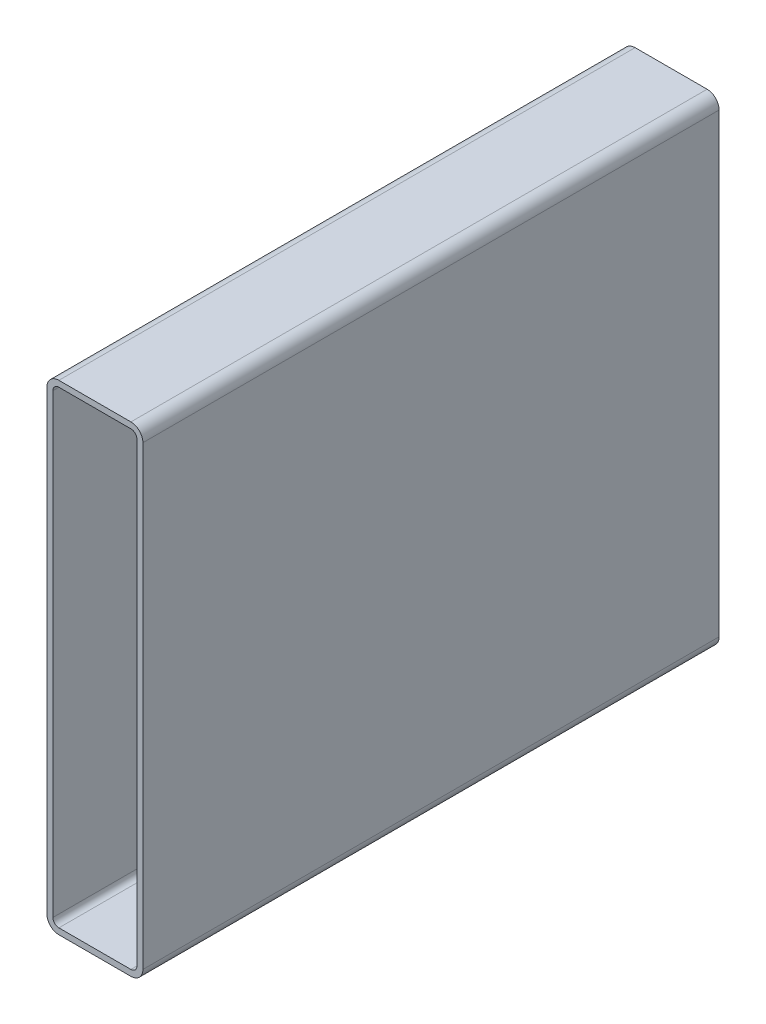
SolidWorks part; units mm, degrees
ref_plane "Front Plane" through (0, 0, 0) normal (0, 0, 1) x (1, 0, 0)
ref_plane "Top Plane" through (0, 0, 0) normal (0, 1, 0) x (1, 0, 0)
ref_plane "Right Plane" through (0, 0, 0) normal (1, 0, 0) x (0, 0, -1)
sketch "Sketch1" plane through (0, 0, 0) normal (0, 0, 1) x (1, 0, 0)
  line B0 (6.35, 254) -> (44.45, 254)
  arc B1 (50.8, 247.65) -> (44.45, 254) centre (44.45, 247.65) ccw
  line B2 (50.8, 247.65) -> (50.8, 6.35)
  arc B3 (44.45, 0) -> (50.8, 6.35) centre (44.45, 6.35) ccw
  line B4 (44.45, 0) -> (6.35, 0)
  arc B5 (0, 6.35) -> (6.35, 0) centre (6.35, 6.35) ccw
  line B6 (0, 6.35) -> (0, 247.65)
  arc B7 (6.35, 254) -> (0, 247.65) centre (6.35, 247.65) ccw
  line B8 (6.35, 250.825) -> (44.45, 250.825)
  arc B9 (47.625, 247.65) -> (44.45, 250.825) centre (44.45, 247.65) ccw
  line B10 (47.625, 247.65) -> (47.625, 6.35)
  arc B11 (44.45, 3.175) -> (47.625, 6.35) centre (44.45, 6.35) ccw
  line B12 (44.45, 3.175) -> (6.35, 3.175)
  arc B13 (3.175, 6.35) -> (6.35, 3.175) centre (6.35, 6.35) ccw
  line B14 (3.175, 6.35) -> (3.175, 247.65)
  arc B15 (6.35, 250.825) -> (3.175, 247.65) centre (6.35, 247.65) ccw
sketch_block_instance "HSS10x2x0.125-1"
sketch_block "HSS10x2x0.125"
extrude "Boss-Extrude1" add sketch "Sketch1" along normal blind 304.8
